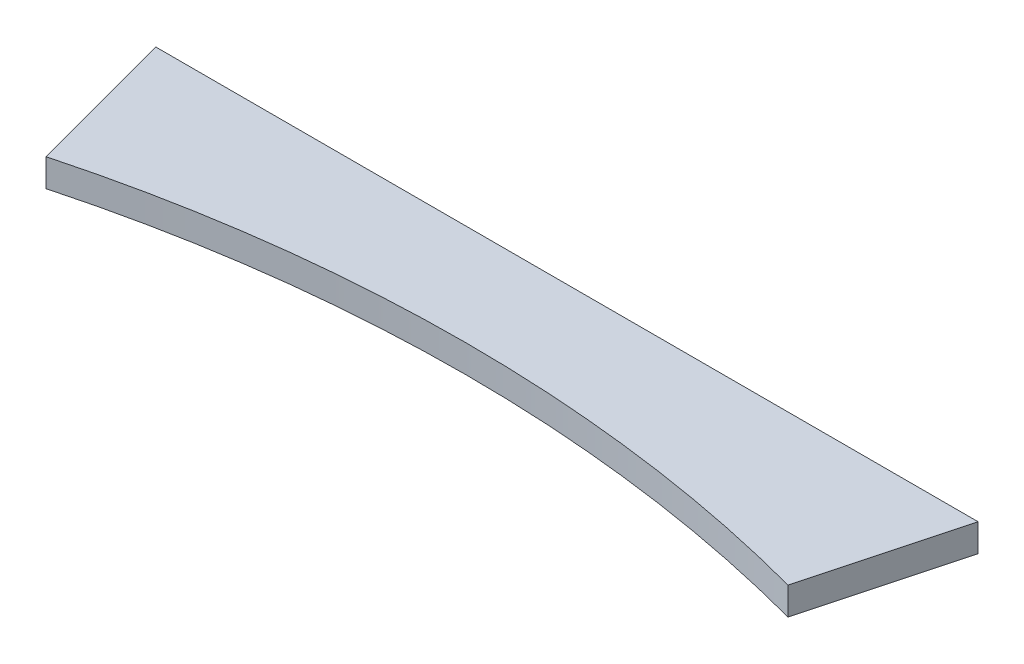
SolidWorks part; units mm, degrees
ref_plane "Plan de face" through (0, 0, 0) normal (0, 0, 1) x (1, 0, 0)
ref_plane "Plan de dessus" through (0, 0, 0) normal (0, 1, 0) x (1, 0, 0)
ref_plane "Plan de droite" through (0, 0, 0) normal (1, 0, 0) x (0, 0, -1)
sketch "Esquisse1" plane through (0, 0, 0) normal (0, 1, 0) x (1, 0, 0)
  line L0 (-222.5, 0) -> (222.5, 0)
  line L1 (-222.5, 0) -> (0, -830.7)
  line L2 (0, -830.7) -> (222.5, 0)
  circle A0 centre (0, -830.7) radius 776
  point P0 (0, -830.7)
  point P4 (0, 0)
  dimension "D1" = 445
  dimension "D2" = 830.7
extrude "Boss.-Extru.1" add sketch "Esquisse1" along normal blind 15 contours A0 L2 L0 L1
